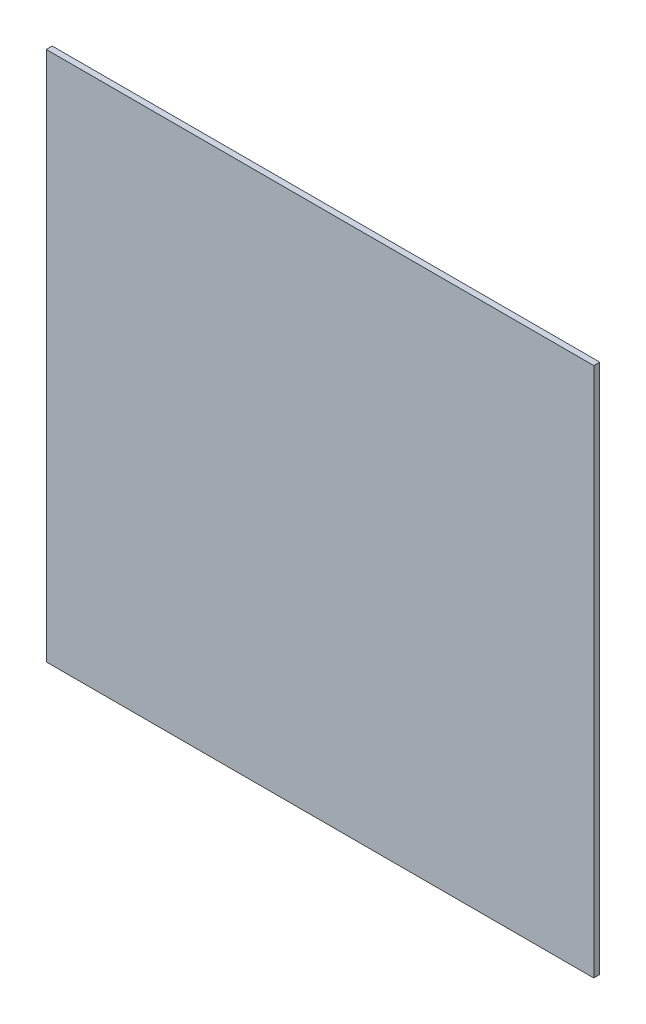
SolidWorks part; units mm, degrees
ref_plane "Front Plane" through (0, 0, 0) normal (0, 0, 1) x (1, 0, 0)
ref_plane "Top Plane" through (0, 0, 0) normal (0, 1, 0) x (1, 0, 0)
ref_plane "Right Plane" through (0, 0, 0) normal (1, 0, 0) x (0, 0, -1)
sketch "Sketch1" plane through (0, 0, 0) normal (0, 0, 1) x (1, 0, 0)
  line L1 (-48, -46.5) -> (48, -46.5)
  line L2 (-48, -46.5) -> (-48, 46.5)
  line L3 (-48, 46.5) -> (48, 46.5)
  line L4 (48, -46.5) -> (48, 46.5)
  line L5 (-48, -46.5) -> (48, 46.5) construction
  line L6 (-48, 46.5) -> (48, -46.5) construction
  point P0 (0, 0)
  dimension "D1" = 96
  dimension "D2" = 93
extrude "Boss-Extrude1" add sketch "Sketch1" along normal blind 1.05
